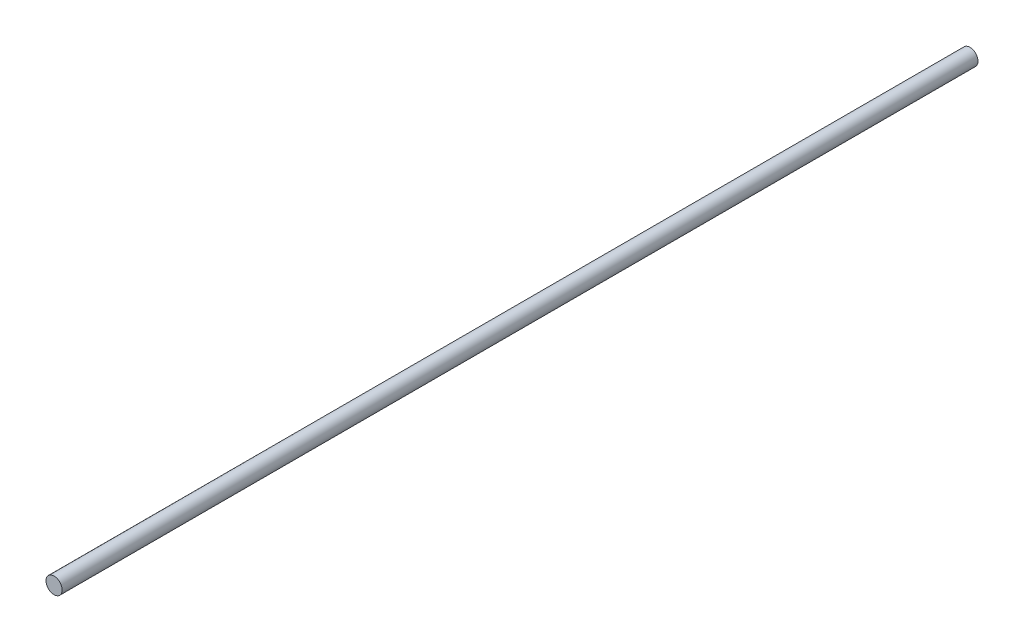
SolidWorks part; units mm, degrees
ref_plane "Plan de face" through (0, 0, 0) normal (0, 0, 1) x (1, 0, 0)
ref_plane "Plan de dessus" through (0, 0, 0) normal (0, 1, 0) x (1, 0, 0)
ref_plane "Plan de droite" through (0, 0, 0) normal (1, 0, 0) x (0, 0, -1)
sketch "Esquisse1" plane through (0, 0, 0) normal (0, 0, 1) x (1, 0, 0)
  circle A0 centre (0, 0) radius 3
  dimension "D1" = 6
extrude "Boss.-Extru.1" add sketch "Esquisse1" along normal blind 340
